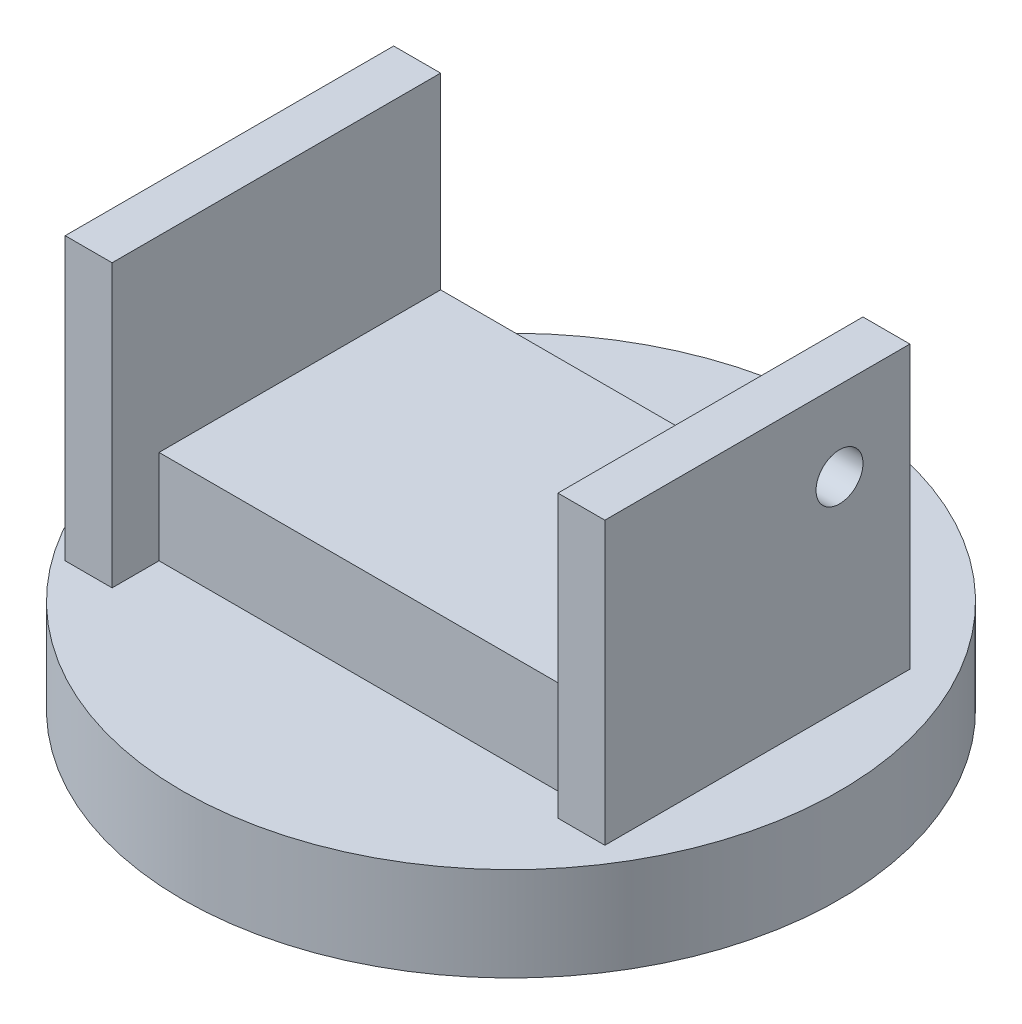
SolidWorks part; units mm, degrees
ref_plane "前视基准面" through (0, 0, 0) normal (0, 0, 1) x (1, 0, 0)
ref_plane "上视基准面" through (0, 0, 0) normal (0, 1, 0) x (1, 0, 0)
ref_plane "右视基准面" through (0, 0, 0) normal (1, 0, 0) x (0, 0, -1)
other "Configuration Table"
sketch "草图1" plane through (0, 0, 0) normal (0, 1, 0) x (1, 0, 0)
  circle A0 centre (0, 0) radius 35
  dimension "D1" = 70
extrude "凸台-拉伸1" add sketch "草图1" along normal blind 10
sketch "草图2" plane through (0, 10, 0) normal (0, 1, 0) x (1, 0, 0)
  line L1 (22.5, -15) -> (-22.5, -15)
  line L2 (22.5, -15) -> (22.5, 15)
  line L3 (22.5, 15) -> (-22.5, 15)
  line L4 (-22.5, -15) -> (-22.5, 15)
  line L5 (22.5, -15) -> (-22.5, 15) construction
  line L6 (22.5, 15) -> (-22.5, -15) construction
  point P0 (0, 0)
  dimension "D1" = 45
  dimension "330" = 30
extrude "凸台-拉伸2" add sketch "草图2" along normal blind 10
sketch "草图3" plane through (0, 10, 0) normal (0, 1, 0) x (1, 0, 0)
  line L1 (-22.5, 15) -> (-27.5, 15)
  line L2 (-22.5, 15) -> (-22.5, -20)
  line L3 (-22.5, -20) -> (-27.5, -20)
  line L4 (-27.5, 15) -> (-27.5, -20)
  dimension "D1" = 35
  dimension "D2" = 5
extrude "凸台-拉伸3" add sketch "草图3" along normal blind 30
sketch "草图4" plane through (0, 10, 0) normal (0, 1, 0) x (1, 0, 0)
  line L1 (22.5, 15) -> (27.5, 15)
  line L2 (22.5, 15) -> (22.5, -17.5)
  line L3 (22.5, -17.5) -> (27.5, -17.5)
  line L4 (27.5, 15) -> (27.5, -17.5)
  dimension "D1" = 5
extrude "凸台-拉伸4" add sketch "草图4" along normal blind 30
sketch "草图5" plane through (-27.5, 0, 0) normal (-1, 0, 0) x (0, 0, 1)
  line L0 (-15, 40) -> (20, 40) construction
  line L1 (-15, 40) -> (-15, 10) construction
  circle A0 centre (-7.5, 31.5) radius 2.4
  dimension "D1" = 4.8
  dimension "D2" = 8.5
  dimension "D3" = 7.5
extrude "凸台-拉伸5" add sketch "草图5" along normal blind 5
sketch "草图6" plane through (27.5, 0, 0) normal (1, 0, 0) x (0, 0, -1)
  line L0 (-17.5, 40) -> (15, 40) construction
  line L1 (15, 40) -> (15, 10) construction
  circle A0 centre (7.5, 31.5) radius 2.5
  dimension "D1" = 5
  dimension "D2" = 8.5
  dimension "D3" = 7.5
extrude "切除-拉伸1" cut sketch "草图6" against normal blind 5
